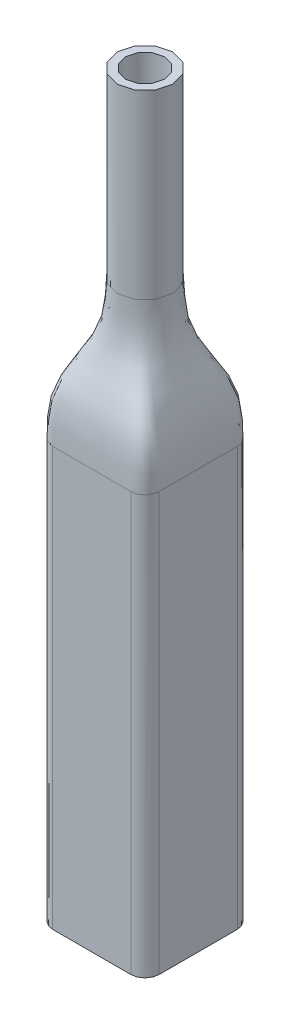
SolidWorks part; units mm, degrees
ref_plane "Front Plane" through (0, 0, 0) normal (0, 0, 1) x (1, 0, 0)
ref_plane "Top Plane" through (0, 0, 0) normal (0, 1, 0) x (1, 0, 0)
ref_plane "Right Plane" through (0, 0, 0) normal (1, 0, 0) x (0, 0, -1)
sketch "Sketch1" plane through (0, 0, 0) normal (0, 1, 0) x (1, 0, 0)
  line L1 (-19.05, -19.05) -> (19.05, -19.05)
  line L2 (-19.05, -19.05) -> (-19.05, 19.05)
  line L3 (-19.05, 19.05) -> (19.05, 19.05)
  line L4 (19.05, -19.05) -> (19.05, 19.05)
  line L5 (0, 19.05) -> (0, -19.05) construction
  line L6 (-19.05, 0) -> (19.05, 0) construction
  point P0 (0, 0)
  dimension "D1" = 38.1
extrude "Boss-Extrude1" add sketch "Sketch1" along normal blind 150
fillet "Fillet1" radius 5 4 edges at (19.05, 75, 19.05) (-19.05, 75, -19.05) (19.05, 75, -19.05) (-19.05, 75, 19.05)
ref_plane "Plane1" through (0, 265, 0) normal (0, 1, 0) x (1, 0, 0)
sketch "Sketch2" plane through (0, 265, 0) normal (0, 1, 0) x (1, 0, 0)
  circle A0 centre (0, 0) radius 10
  dimension "D1" = 20
extrude "Boss-Extrude2" add sketch "Sketch2" against normal blind 65 separate body
other "Boundary1"
shell "Shell1" thickness 3
